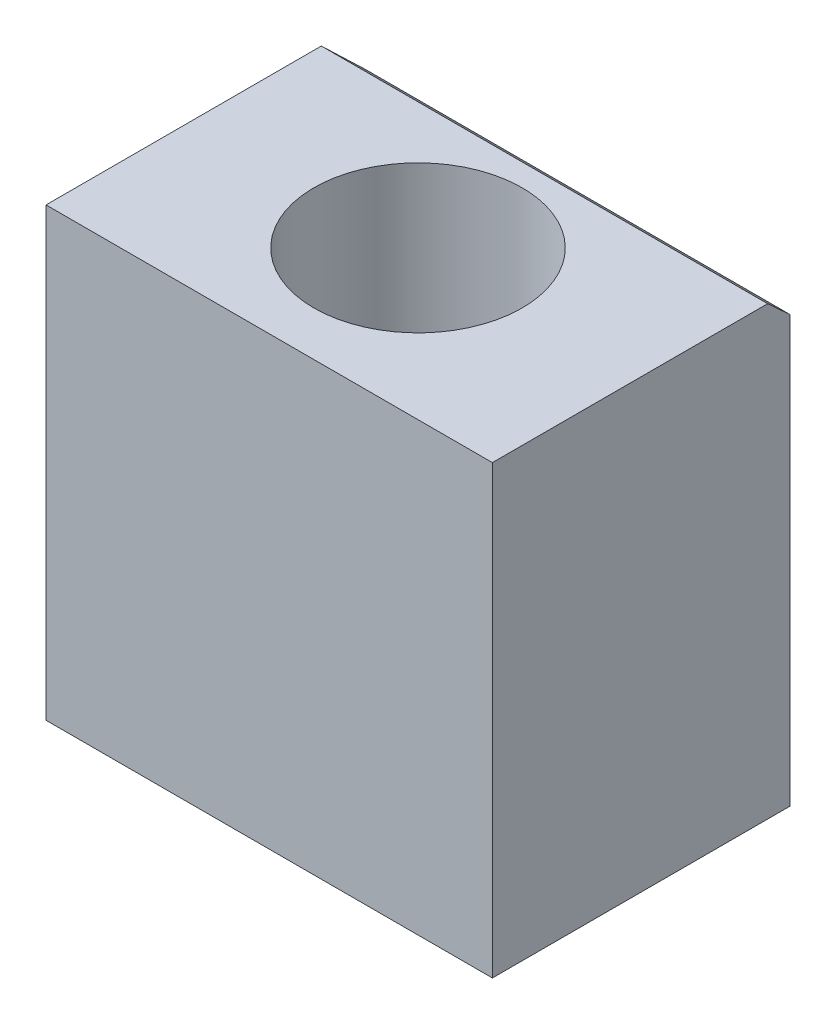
SolidWorks part; units mm, degrees
ref_plane "Face" through (0, 0, 0) normal (0, 0, 1) x (1, 0, 0)
ref_plane "Dessus" through (0, 0, 0) normal (0, 1, 0) x (1, 0, 0)
ref_plane "Droite" through (0, 0, 0) normal (1, 0, 0) x (0, 0, -1)
sketch "Esquisse2" plane through (0, 0, 0) normal (0, 0, 1) x (1, 0, 0)
  line L1 (0, 0) -> (30, 0)
  line L2 (0, 0) -> (0, -30)
  line L3 (0, -30) -> (30, -30)
  line L4 (30, 0) -> (30, -30)
  dimension "D1" = 30
  dimension "D2" = 30
extrude "Extrusion1" add sketch "Esquisse2" along normal blind 20
hole_wizard "Trou taraudé M161" positions "Esquisse4" profile "Esquisse3" tap size "M16" standard "ISO"
sketch "Esquisse4" plane through (0, 0, 0) normal (0, 1, 0) x (-1, 0, 0)
  line L0 (-30, 20) -> (-30, 0) construction
  line L1 (-30, 20) -> (0, 20) construction
  point P0 (-15, 10)
  dimension "D1" = 15
  dimension "D2" = 10
sketch "Esquisse3" plane through (15, 0, 10) normal (1, 0, 0) x (0, 0, 1)
  line L0 (0, 0) -> (0, 42.206)
  line L1 (0, 42.206) -> (7, 38)
  line L2 (7, 38) -> (7, 0)
  line L5 (7, 0) -> (0, 0)
  line L10 (0, 42.206) -> (-7, 38) construction
  line L11 (0, -6.35) -> (0, 107.95) construction
  dimension "Diamètre du trou pour taraudage" = 14
  dimension "Profondeur du trou pour taraudage" = 38
  dimension "Angle de pointe" = 118
sketch "Esquisse5" plane through (30, 0, 0) normal (1, 0, 0) x (0, 0, -1)
  line L0 (0, 0) -> (-1.5, 0)
  line L1 (-20, 0) -> (0, 0) construction
  line L2 (-1.5, 0) -> (0, -1.3774)
  line L3 (0, -30) -> (0, 0) construction
  line L4 (0, -1.3774) -> (0, 0)
  dimension "D1" = 1.5
extrude "Enlèv. mat.-Extru.1" cut sketch "Esquisse5" against normal blind 30
sketch "Esquisse9" plane through (0, 0, 0) normal (0, 1, 0) x (1, 0, 0)
  line L0 (0, -1.5) -> (1.5, 0)
  line L1 (0, 0) -> (30, 0) construction
  line L2 (1.5, 0) -> (0, 0)
  line L3 (0, 0) -> (0, -1.5)
  dimension "D1" = 1.5
extrude "Enlèv. mat.-Extru.2" cut sketch "Esquisse9" against normal blind 30
